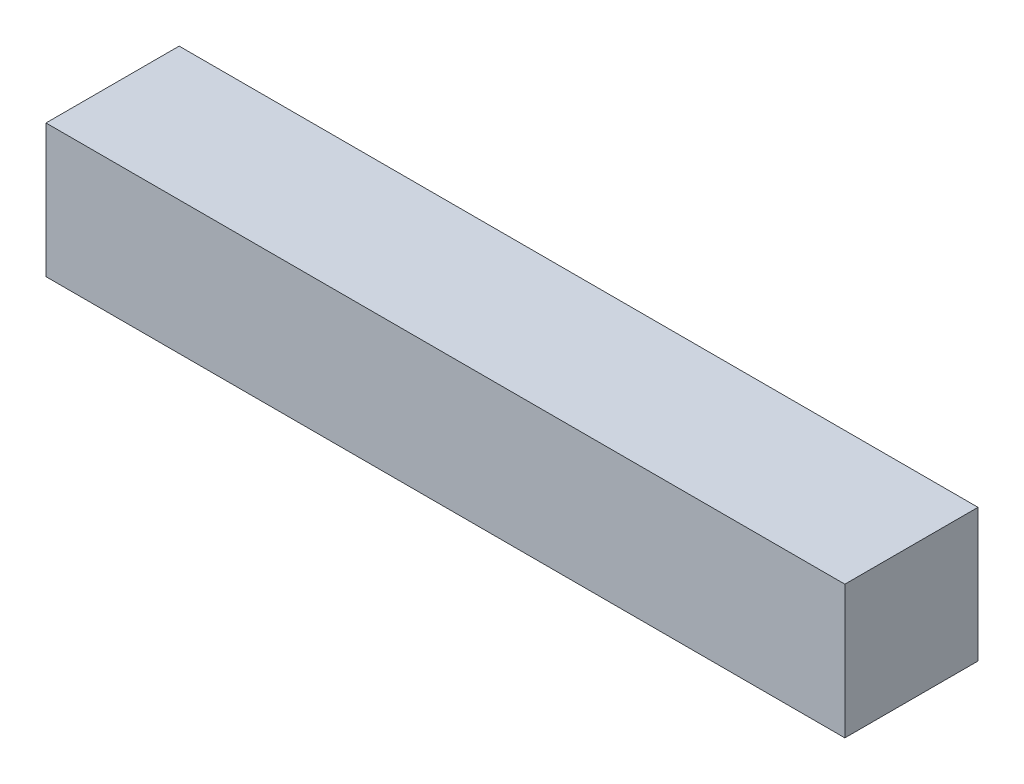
SolidWorks part; units mm, degrees
ref_plane "Front Plane" through (0, 0, 0) normal (0, 0, 1) x (1, 0, 0)
ref_plane "Top Plane" through (0, 0, 0) normal (0, 1, 0) x (1, 0, 0)
ref_plane "Right Plane" through (0, 0, 0) normal (1, 0, 0) x (0, 0, -1)
sketch "Sketch1" plane through (0, 0, 0) normal (0, 1, 0) x (1, 0, 0)
  line L1 (0, 0) -> (120, 0)
  line L2 (0, 0) -> (0, 20)
  line L3 (0, 20) -> (120, 20)
  line L4 (120, 0) -> (120, 20)
  dimension "D1" = 120
  dimension "D2" = 20
extrude "Extrude1" add sketch "Sketch1" along normal blind 20
